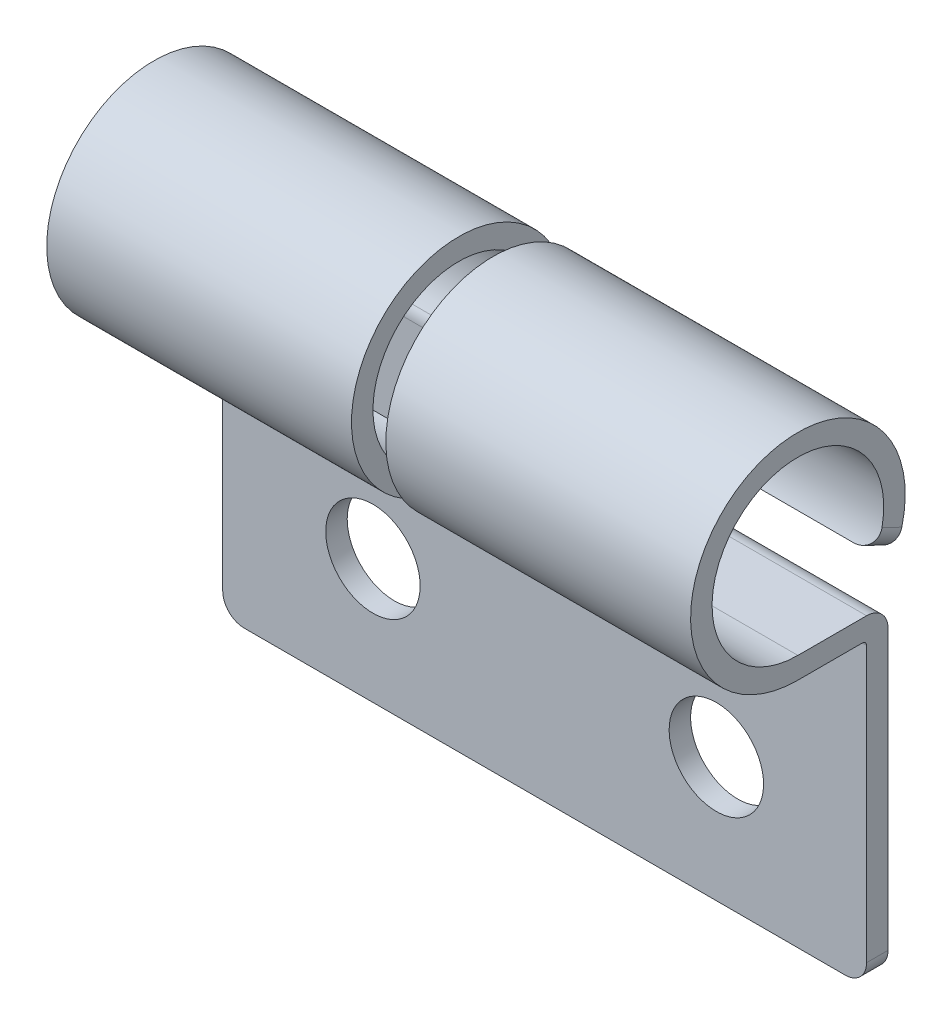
SolidWorks part; units mm, degrees
ref_plane "Front Plane" through (0, 0, 0) normal (0, 0, 1) x (1, 0, 0)
ref_plane "Top Plane" through (0, 0, 0) normal (0, 1, 0) x (1, 0, 0)
ref_plane "Right Plane" through (0, 0, 0) normal (1, 0, 0) x (0, 0, -1)
sketch "Sketch1" plane through (0, 0, 0) normal (1, 0, 0) x (0, 0, -1)
  line L0 (0, -2) -> (1.6, -2)
  line L1 (2.1, -2.5) -> (2.1, -9.5)
  arc A0 (1.7976, -0.8767) -> (0, -2) centre (0, 0) ccw
  arc A1 (1.6, -2) -> (2.1, -2.5) centre (1.6, -2.5) cw
  point P5 (1.7976, -0.8767)
  dimension "D1" = 4
  dimension "D4" = 0.5
  dimension "D2" = 2.1
  dimension "D3" = 9.5
extrude "Extrude-Thin1" add sketch "Sketch1" along normal blind 7.5 thin
sketch "Sketch3" plane through (0, 0, 0) normal (-1, 0, 0) x (0, 0, 1)
  line L0 (-1.6, -9.5) -> (-1.6, -1.3565)
  line L1 (0, -2) -> (-1.6, -2) construction
  arc A0 (0, -2) -> (-1.68, -1.0852) centre (0, 0) ccw
  arc A1 (-1.6, -1.3565) -> (-1.68, -1.0852) centre (-2.1, -1.3565) ccw
  dimension "D1" = 0.5
extrude "Extrude-Thin2" add sketch "Sketch3" along normal blind 7.5 thin
sketch "Sketch4" plane through (0, 0, 0) normal (0, 0, 1) x (1, 0, 0)
  line L0 (7.5, 2.5) -> (-7.5, 2.5) construction
  line L2 (-0.4, -3.1) -> (-0.4, 2.5)
  line L3 (-0.4, 2.5) -> (0.4, 2.5)
  line L4 (0.4, -3.1) -> (0.4, 2.5)
  arc A0 (-0.4, -3.1) -> (0.4, -3.1) centre (0, -3.1) ccw
  point P0 (0, 0)
  dimension "D2" = 6
  dimension "D1" = 0.8
  dimension "D3" = 0.4
extrude "Cut-Extrude2" cut sketch "Sketch4" against normal mid plane 5
sketch "Sketch2" plane through (0, 0, -2.1) normal (0, 0, -1) x (-1, 0, 0)
  line L0 (0, -9.5) -> (0, -3.2136) construction
  line L1 (-7.5, -9.5) -> (7.5, -9.5) construction
  circle A0 centre (4, -6.6) radius 1.1
  circle A1 centre (-4, -6.6) radius 1.1
  dimension "D1" = 4
  dimension "D3" = 2.2
  dimension "D4" = 6.6
extrude "Cut-Extrude1" cut sketch "Sketch2" against normal through all
fillet "Fillet1" radius 0.5 8 edges at (7.5, -0.9863, -2.0223) (-7.5, -9.5, -1.85) (-7.5, -2.25, 0) (-0.4, -2.25, 0) (0.4, -0.9863, -2.0223) (7.5, -9.5, -1.85)
fillet "Fillet2" radius 0.1 2 edges at (-3.95, -1.3565, -2.1)
